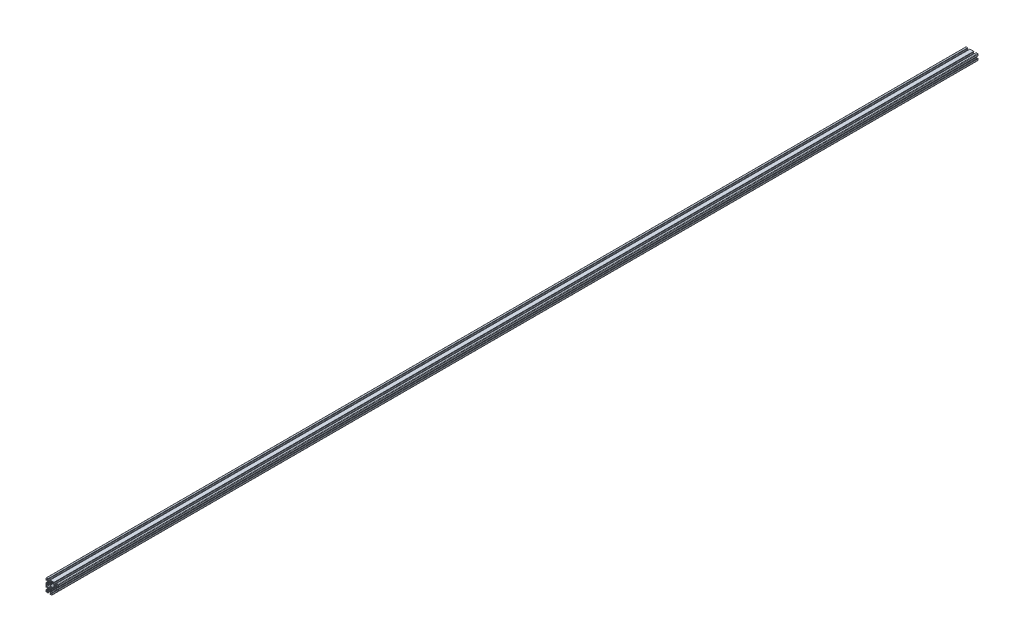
SolidWorks part; units mm, degrees
ref_plane "Front Plane" through (0, 0, 0) normal (0, 0, 1) x (1, 0, 0)
ref_plane "Top Plane" through (0, 0, 0) normal (0, 1, 0) x (1, 0, 0)
ref_plane "Right Plane" through (0, 0, 0) normal (1, 0, 0) x (0, 0, -1)
sketch "Sketch1" plane through (0, 0, 0) normal (0, 0, 1) x (1, 0, 0)
  line L0 (-3.2322, -4.5) -> (-0.9536, -4.5)
  line L1 (-0.8536, -4.4732) -> (-0.1, -4.0381)
  line L2 (0.1, -4.0381) -> (0.8536, -4.4732)
  line L3 (0.9536, -4.5) -> (3.2322, -4.5)
  line L4 (3.5858, -4.6464) -> (8.3536, -9.4142)
  line L5 (8.5, -12) -> (8.5, -9.7678)
  line L6 (-3.55, 9.7) -> (-3.55, 9.8)
  line L7 (-3.35, 9.5) -> (-3.2, 9.5)
  line L8 (-3, 9) -> (-3, 9.3)
  line L9 (-5.5, 8.5) -> (-3.5, 8.5)
  line L10 (-6, 7.2678) -> (-6, 8)
  line L12 (-3.2322, 4.5) -> (-0.9536, 4.5)
  line L13 (-0.8536, 4.4732) -> (-0.1, 4.0381)
  line L14 (0.1, 4.0381) -> (0.8536, 4.4732)
  line L15 (0.9536, 4.5) -> (3.2322, 4.5)
  line L16 (3.5858, 4.6464) -> (5.8536, 6.9142)
  line L17 (6, 7.2678) -> (6, 8)
  line L18 (5.5, 8.5) -> (3.5, 8.5)
  line L19 (3, 9) -> (3, 9.3)
  line L20 (3.2, 9.5) -> (3.3, 9.5)
  line L21 (3.5, 9.7) -> (3.5, 9.8)
  line L23 (3.7, 10) -> (16.2, 10)
  line L24 (16.4, 9.7) -> (16.4, 9.8)
  line L25 (16.6, 9.5) -> (16.8, 9.5)
  line L26 (17, 9) -> (17, 9.3)
  line L27 (14.5, 8.5) -> (16.5, 8.5)
  line L28 (14, 7.2678) -> (14, 8)
  line L29 (14.1464, 6.9142) -> (16.4142, 4.6464)
  line L30 (16.7678, 4.5) -> (19.0464, 4.5)
  line L31 (19.1464, 4.4732) -> (19.9, 4.0381)
  line L32 (20.1, 4.0381) -> (20.8536, 4.4732)
  line L33 (20.9536, 4.5) -> (23.2322, 4.5)
  line L34 (23.5858, 4.6464) -> (25.8536, 6.9142)
  line L35 (26, 7.2678) -> (26, 8)
  line L36 (25.5, 8.5) -> (23.5, 8.5)
  line L37 (23, 9) -> (23, 9.3)
  line L38 (23.2, 9.5) -> (23.3, 9.5)
  line L39 (23.5, 9.7) -> (23.5, 9.8)
  line L40 (23.7, 10) -> (28.5, 10)
  line L41 (30, 3.7) -> (30, 8.5)
  line L42 (29.7, 3.5) -> (29.8, 3.5)
  line L43 (29.5, 3.2) -> (29.5, 3.3)
  line L44 (29, 3) -> (29.3, 3)
  line L45 (28.5, 3.5) -> (28.5, 5.5)
  line L46 (27.2678, 6) -> (28, 6)
  line L47 (24.6464, 3.5858) -> (26.9142, 5.8536)
  line L48 (24.5, 0.9536) -> (24.5, 3.2322)
  line L49 (24.0381, 0.1) -> (24.4732, 0.8536)
  line L50 (24.0381, -0.1) -> (24.4732, -0.8536)
  line L51 (24.5, -3.2322) -> (24.5, -0.9536)
  line L52 (24.6464, -3.5858) -> (26.9142, -5.8536)
  line L53 (27.2678, -6) -> (28, -6)
  line L54 (28.5, -5.5) -> (28.5, -3.5)
  line L55 (29, -3) -> (29.3, -3)
  line L56 (29.5, -3.3) -> (29.5, -3.2)
  line L57 (29.7, -3.5) -> (29.8, -3.5)
  line L58 (30, -8.5) -> (30, -3.7)
  line L59 (23.7, -10) -> (28.5, -10)
  line L60 (23.5, -9.8) -> (23.5, -9.7)
  line L61 (23.2, -9.5) -> (23.3, -9.5)
  line L62 (23, -9.3) -> (23, -9)
  line L63 (23.5, -8.5) -> (25.5, -8.5)
  line L64 (26, -8) -> (26, -7.2678)
  line L65 (25.8536, -6.9142) -> (23.5858, -4.6464)
  line L66 (23.2322, -4.5) -> (20.9536, -4.5)
  line L67 (20.8536, -4.4732) -> (20.1, -4.0381)
  line L68 (19.1464, -4.4732) -> (19.9, -4.0381)
  line L69 (19.0464, -4.5) -> (16.7678, -4.5)
  line L70 (14.1464, -6.9142) -> (16.4142, -4.6464)
  line L71 (14, -8) -> (14, -7.2678)
  line L72 (14.5, -8.5) -> (16.5, -8.5)
  line L73 (17, -9.3) -> (17, -9)
  line L74 (16.65, -9.5) -> (16.8, -9.5)
  line L75 (16.45, -9.8) -> (16.45, -9.7)
  line L76 (11.5, -10) -> (16.25, -10)
  line L77 (10, -16.3) -> (10, -11.5)
  line L78 (9.8, -16.5) -> (9.7, -16.5)
  line L79 (9.5, -16.8) -> (9.5, -16.7)
  line L80 (9.3, -17) -> (9, -17)
  line L81 (8.5, -16.5) -> (8.5, -14.5)
  line L82 (7.2678, -14) -> (8, -14)
  line L83 (4.6464, -16.4142) -> (6.9142, -14.1464)
  line L84 (4.5, -19.0464) -> (4.5, -16.7678)
  line L85 (4.0381, -19.9) -> (4.4732, -19.1464)
  line L86 (4.0381, -20.1) -> (4.4732, -20.8536)
  line L87 (4.5, -23.2322) -> (4.5, -20.9536)
  line L88 (4.6464, -23.5858) -> (6.9142, -25.8536)
  line L89 (7.2678, -26) -> (8, -26)
  line L90 (8.5, -25.5) -> (8.5, -23.5)
  line L91 (9, -23) -> (9.3, -23)
  line L92 (9.5, -23.3) -> (9.5, -23.2)
  line L93 (9.7, -23.5) -> (9.8, -23.5)
  line L94 (10, -28.5) -> (10, -23.7)
  line L95 (8.5, -30) -> (3.7, -30)
  line L96 (3.5, -29.8) -> (3.5, -29.7)
  line L97 (3.3, -29.5) -> (3.2, -29.5)
  line L98 (3, -29.3) -> (3, -29)
  line L99 (3.5, -28.5) -> (5.5, -28.5)
  line L100 (6, -28) -> (6, -27.2678)
  line L101 (5.8536, -26.9142) -> (3.5858, -24.6464)
  line L102 (3.2322, -24.5) -> (0.9536, -24.5)
  line L103 (0.8536, -24.4732) -> (0.1, -24.0381)
  line L104 (-0.8536, -24.4732) -> (-0.1, -24.0381)
  line L105 (-0.9536, -24.5) -> (-3.2322, -24.5)
  line L106 (-5.8536, -26.9142) -> (-3.5858, -24.6464)
  line L107 (-6, -28) -> (-6, -27.2678)
  line L108 (-5.5, -28.5) -> (-3.5, -28.5)
  line L109 (-3, -29.3) -> (-3, -29)
  line L110 (-3.2, -29.5) -> (-3.3, -29.5)
  line L111 (-3.5, -29.8) -> (-3.5, -29.7)
  line L112 (-3.7, -30) -> (-8.5, -30)
  line L113 (-10, -28.5) -> (-10, -23.75)
  line L114 (-9.8, -23.55) -> (-9.7, -23.55)
  line L115 (-9.5, -23.35) -> (-9.5, -23.2)
  line L116 (-9.3, -23) -> (-9, -23)
  line L117 (-8.5, -23.5) -> (-8.5, -25.5)
  line L118 (-8, -26) -> (-7.2678, -26)
  line L119 (-6.9142, -25.8536) -> (-4.6464, -23.5858)
  line L120 (-4.5, -23.2322) -> (-4.5, -20.9536)
  line L121 (-4.4732, -20.8536) -> (-4.0381, -20.1)
  line L122 (-4.0381, -19.9) -> (-4.4732, -19.1464)
  line L123 (-4.5, -19.0464) -> (-4.5, -16.7678)
  line L124 (-4.6464, -16.4142) -> (-6.9142, -14.1464)
  line L125 (-7.2678, -14) -> (-8, -14)
  line L126 (-8.5, -16.5) -> (-8.5, -14.5)
  line L127 (-9, -17) -> (-9.3, -17)
  line L128 (-9.5, -16.8) -> (-9.5, -16.65)
  line L129 (-9.7, -16.45) -> (-9.8, -16.45)
  line L131 (2.5259, 1.3623) -> (2.8916, 1.8006)
  line L132 (1.3623, 2.5259) -> (1.8006, 2.8916)
  line L133 (-1.3623, 2.5259) -> (-1.8006, 2.8916)
  line L134 (-2.8912, 1.8002) -> (-2.5243, 1.3629)
  line L135 (-2.8912, -1.8002) -> (-2.5243, -1.3629)
  line L136 (-1.7927, -2.8965) -> (-1.3554, -2.5296)
  line L137 (1.3623, -2.5259) -> (1.8006, -2.8916)
  line L138 (2.8916, -1.8006) -> (2.5259, -1.3623)
  line L139 (3.2322, -15.5) -> (0.9536, -15.5)
  line L140 (-1.3623, -17.4741) -> (-1.8006, -17.1084)
  line L141 (-2.8916, -18.1994) -> (-2.5259, -18.6377)
  line L142 (-2.8916, -21.8006) -> (-2.5259, -21.3623)
  line L143 (-1.8006, -22.8916) -> (-1.3623, -22.5259)
  line L144 (1.3623, -22.5259) -> (1.8006, -22.8916)
  line L145 (2.8916, -21.8006) -> (2.5259, -21.3623)
  line L146 (2.5259, -18.6377) -> (2.8916, -18.1994)
  line L147 (1.3623, -17.4741) -> (1.8006, -17.1084)
  line L148 (-8.5, -12) -> (-8.5, -8)
  line L149 (-7.2678, -12.5) -> (-8, -12.5)
  line L150 (-0.9536, -15.5) -> (-3.2322, -15.5)
  line L151 (-3.5858, -15.3536) -> (-5.8536, -13.0858)
  line L152 (0.8536, -15.5268) -> (0.1, -15.9619)
  line L153 (-0.1, -15.9619) -> (-0.8536, -15.5268)
  line L154 (-9.8, 3.55) -> (-9.7, 3.55)
  line L155 (-9.5, 3.2) -> (-9.5, 3.35)
  line L156 (-9.3, 3) -> (-9, 3)
  line L157 (-8.5, 3.5) -> (-8.5, 5.5)
  line L158 (-8, 6) -> (-7.2678, 6)
  line L159 (-6.9142, 5.8536) -> (-4.6464, 3.5858)
  line L160 (-4.5, 0.9536) -> (-4.5, 3.2322)
  line L161 (-4.4732, 0.8536) -> (-4.0381, 0.1)
  line L162 (-4.4732, -0.8536) -> (-4.0381, -0.1)
  line L163 (-4.5, -3.2322) -> (-4.5, -0.9536)
  line L164 (-6.9142, -5.8536) -> (-4.6464, -3.5858)
  line L165 (-7.2678, -6) -> (-8, -6)
  line L166 (-8.5, -5.5) -> (-8.5, -3.5)
  line L167 (-9, -3) -> (-9.3, -3)
  line L168 (-9.5, -3.35) -> (-9.5, -3.2)
  line L169 (-9.7, -3.55) -> (-9.8, -3.55)
  line L170 (-10, 3.75) -> (-10, 8.5)
  line L171 (-8.5, 10) -> (-3.75, 10)
  line L172 (-10, -16.25) -> (-10, -3.75)
  line L173 (-7.2678, -7.5) -> (-8, -7.5)
  line L174 (-3.5858, -4.6464) -> (-5.8536, -6.9142)
  line L175 (-3.5858, 4.6464) -> (-5.8536, 6.9142)
  line L176 (5.8536, -13.0858) -> (3.5858, -15.3536)
  line L177 (7.2678, -12.5) -> (8, -12.5)
  line L178 (17.4688, 1.3572) -> (17.1088, 1.8002)
  line L179 (18.1998, 2.8912) -> (18.6428, 2.5312)
  line L180 (21.3554, 2.5296) -> (21.7983, 2.8897)
  line L181 (22.5296, 1.3554) -> (22.8897, 1.7983)
  line L182 (22.5296, -1.3554) -> (22.8897, -1.7983)
  line L183 (21.7983, -2.8897) -> (21.3554, -2.5296)
  line L184 (18.1998, -2.8912) -> (18.6428, -2.5312)
  line L185 (17.1088, -1.8002) -> (17.4688, -1.3572)
  line L186 (12, -8.5) -> (9.7678, -8.5)
  line L187 (12, 8.5) -> (8, 8.5)
  line L188 (4.0381, 0.1) -> (4.4732, 0.8536)
  line L189 (9.4142, -8.3536) -> (4.6464, -3.5858)
  line L190 (4.5, -3.2322) -> (4.5, -0.9536)
  line L191 (4.4732, -0.8536) -> (4.0381, -0.1)
  line L192 (4.6464, 3.5858) -> (6.9142, 5.8536)
  line L193 (4.5, 0.9536) -> (4.5, 3.2322)
  line L194 (7.5, 7.2678) -> (7.5, 8)
  line L195 (15.9619, 0.1) -> (15.5268, 0.8536)
  line L196 (15.5268, -0.8536) -> (15.9619, -0.1)
  line L197 (13.0858, -5.8536) -> (15.3536, -3.5858)
  line L198 (12.5, -7.2678) -> (12.5, -8)
  line L199 (15.5, -3.2322) -> (15.5, -0.9536)
  line L200 (15.3536, 3.5858) -> (13.0858, 5.8536)
  line L201 (15.5, 0.9536) -> (15.5, 3.2322)
  line L202 (12.5, 7.2678) -> (12.5, 8)
  line L203 (0, 11.9931) -> (0, -30.4658) construction
  line L204 (-13.2913, 0) -> (29.7, 0) construction
  line L205 (20, 11.9931) -> (20, -22.0156) construction
  line L206 (-15.5823, -20) -> (12, -20) construction
  line L207 (10, 11.9931) -> (10, -32.444) construction
  line L208 (-14.6648, -10) -> (36.8031, -10) construction
  arc A0 (-0.9536, -4.5) -> (-0.8536, -4.4732) centre (-0.9536, -4.3) ccw
  arc A1 (0.1, -4.0381) -> (-0.1, -4.0381) centre (0, -4.2113) ccw
  arc A2 (0.8536, -4.4732) -> (0.9536, -4.5) centre (0.9536, -4.3) ccw
  arc A3 (3.5858, -4.6464) -> (3.2322, -4.5) centre (3.2322, -5) ccw
  arc A4 (8.5, -9.7678) -> (8.3536, -9.4142) centre (8, -9.7678) ccw
  arc A5 (-3.55, 9.8) -> (-3.75, 10) centre (-3.75, 9.8) ccw
  arc A6 (-3.55, 9.7) -> (-3.35, 9.5) centre (-3.35, 9.7) ccw
  arc A7 (-3, 9.3) -> (-3.2, 9.5) centre (-3.2, 9.3) ccw
  arc A8 (-3.5, 8.5) -> (-3, 9) centre (-3.5, 9) ccw
  arc A9 (-5.5, 8.5) -> (-6, 8) centre (-5.5, 8) ccw
  arc A10 (-6, 7.2678) -> (-5.8536, 6.9142) centre (-5.5, 7.2678) ccw
  arc A11 (-3.5858, 4.6464) -> (-3.2322, 4.5) centre (-3.2322, 5) ccw
  arc A12 (-0.8536, 4.4732) -> (-0.9536, 4.5) centre (-0.9536, 4.3) ccw
  arc A13 (-0.1, 4.0381) -> (0.1, 4.0381) centre (0, 4.2113) ccw
  arc A14 (0.9536, 4.5) -> (0.8536, 4.4732) centre (0.9536, 4.3) ccw
  arc A15 (3.2322, 4.5) -> (3.5858, 4.6464) centre (3.2322, 5) ccw
  arc A16 (5.8536, 6.9142) -> (6, 7.2678) centre (5.5, 7.2678) ccw
  arc A17 (6, 8) -> (5.5, 8.5) centre (5.5, 8) ccw
  arc A18 (3, 9) -> (3.5, 8.5) centre (3.5, 9) ccw
  arc A19 (3.2, 9.5) -> (3, 9.3) centre (3.2, 9.3) ccw
  arc A20 (3.3, 9.5) -> (3.5, 9.7) centre (3.3, 9.7) ccw
  arc A21 (3.7, 10) -> (3.5, 9.8) centre (3.7, 9.8) ccw
  arc A22 (16.4, 9.8) -> (16.2, 10) centre (16.2, 9.8) ccw
  arc A23 (16.4, 9.7) -> (16.6, 9.5) centre (16.6, 9.7) ccw
  arc A24 (17, 9.3) -> (16.8, 9.5) centre (16.8, 9.3) ccw
  arc A25 (16.5, 8.5) -> (17, 9) centre (16.5, 9) ccw
  arc A26 (14.5, 8.5) -> (14, 8) centre (14.5, 8) ccw
  arc A27 (14, 7.2678) -> (14.1464, 6.9142) centre (14.5, 7.2678) ccw
  arc A28 (16.4142, 4.6464) -> (16.7678, 4.5) centre (16.7678, 5) ccw
  arc A29 (19.1464, 4.4732) -> (19.0464, 4.5) centre (19.0464, 4.3) ccw
  arc A30 (19.9, 4.0381) -> (20.1, 4.0381) centre (20, 4.2113) ccw
  arc A31 (20.9536, 4.5) -> (20.8536, 4.4732) centre (20.9536, 4.3) ccw
  arc A32 (23.2322, 4.5) -> (23.5858, 4.6464) centre (23.2322, 5) ccw
  arc A33 (25.8536, 6.9142) -> (26, 7.2678) centre (25.5, 7.2678) ccw
  arc A34 (26, 8) -> (25.5, 8.5) centre (25.5, 8) ccw
  arc A35 (23, 9) -> (23.5, 8.5) centre (23.5, 9) ccw
  arc A36 (23.2, 9.5) -> (23, 9.3) centre (23.2, 9.3) ccw
  arc A37 (23.3, 9.5) -> (23.5, 9.7) centre (23.3, 9.7) ccw
  arc A38 (23.7, 10) -> (23.5, 9.8) centre (23.7, 9.8) ccw
  arc A39 (30, 8.5) -> (28.5, 10) centre (28.5, 8.5) ccw
  arc A40 (29.8, 3.5) -> (30, 3.7) centre (29.8, 3.7) ccw
  arc A41 (29.7, 3.5) -> (29.5, 3.3) centre (29.7, 3.3) ccw
  arc A42 (29.3, 3) -> (29.5, 3.2) centre (29.3, 3.2) ccw
  arc A43 (28.5, 3.5) -> (29, 3) centre (29, 3.5) ccw
  arc A44 (28.5, 5.5) -> (28, 6) centre (28, 5.5) ccw
  arc A45 (27.2678, 6) -> (26.9142, 5.8536) centre (27.2678, 5.5) ccw
  arc A46 (24.6464, 3.5858) -> (24.5, 3.2322) centre (25, 3.2322) ccw
  arc A47 (24.4732, 0.8536) -> (24.5, 0.9536) centre (24.3, 0.9536) ccw
  arc A48 (24.0381, 0.1) -> (24.0381, -0.1) centre (24.2113, 0) ccw
  arc A49 (24.5, -0.9536) -> (24.4732, -0.8536) centre (24.3, -0.9536) ccw
  arc A50 (24.5, -3.2322) -> (24.6464, -3.5858) centre (25, -3.2322) ccw
  arc A51 (26.9142, -5.8536) -> (27.2678, -6) centre (27.2678, -5.5) ccw
  arc A52 (28, -6) -> (28.5, -5.5) centre (28, -5.5) ccw
  arc A53 (29, -3) -> (28.5, -3.5) centre (29, -3.5) ccw
  arc A54 (29.5, -3.2) -> (29.3, -3) centre (29.3, -3.2) ccw
  arc A55 (29.5, -3.3) -> (29.7, -3.5) centre (29.7, -3.3) ccw
  arc A56 (30, -3.7) -> (29.8, -3.5) centre (29.8, -3.7) ccw
  arc A57 (28.5, -10) -> (30, -8.5) centre (28.5, -8.5) ccw
  arc A58 (23.5, -9.8) -> (23.7, -10) centre (23.7, -9.8) ccw
  arc A59 (23.5, -9.7) -> (23.3, -9.5) centre (23.3, -9.7) ccw
  arc A60 (23, -9.3) -> (23.2, -9.5) centre (23.2, -9.3) ccw
  arc A61 (23.5, -8.5) -> (23, -9) centre (23.5, -9) ccw
  arc A62 (25.5, -8.5) -> (26, -8) centre (25.5, -8) ccw
  arc A63 (26, -7.2678) -> (25.8536, -6.9142) centre (25.5, -7.2678) ccw
  arc A64 (23.5858, -4.6464) -> (23.2322, -4.5) centre (23.2322, -5) ccw
  arc A65 (20.8536, -4.4732) -> (20.9536, -4.5) centre (20.9536, -4.3) ccw
  arc A66 (20.1, -4.0381) -> (19.9, -4.0381) centre (20, -4.2113) ccw
  arc A67 (19.0464, -4.5) -> (19.1464, -4.4732) centre (19.0464, -4.3) ccw
  arc A68 (16.7678, -4.5) -> (16.4142, -4.6464) centre (16.7678, -5) ccw
  arc A69 (14.1464, -6.9142) -> (14, -7.2678) centre (14.5, -7.2678) ccw
  arc A70 (14, -8) -> (14.5, -8.5) centre (14.5, -8) ccw
  arc A71 (17, -9) -> (16.5, -8.5) centre (16.5, -9) ccw
  arc A72 (16.8, -9.5) -> (17, -9.3) centre (16.8, -9.3) ccw
  arc A73 (16.65, -9.5) -> (16.45, -9.7) centre (16.65, -9.7) ccw
  arc A74 (16.25, -10) -> (16.45, -9.8) centre (16.25, -9.8) ccw
  arc A75 (11.5, -10) -> (10, -11.5) centre (11.5, -11.5) ccw
  arc A76 (9.8, -16.5) -> (10, -16.3) centre (9.8, -16.3) ccw
  arc A77 (9.7, -16.5) -> (9.5, -16.7) centre (9.7, -16.7) ccw
  arc A78 (9.3, -17) -> (9.5, -16.8) centre (9.3, -16.8) ccw
  arc A79 (8.5, -16.5) -> (9, -17) centre (9, -16.5) ccw
  arc A80 (8.5, -14.5) -> (8, -14) centre (8, -14.5) ccw
  arc A81 (7.2678, -14) -> (6.9142, -14.1464) centre (7.2678, -14.5) ccw
  arc A82 (4.6464, -16.4142) -> (4.5, -16.7678) centre (5, -16.7678) ccw
  arc A83 (4.4732, -19.1464) -> (4.5, -19.0464) centre (4.3, -19.0464) ccw
  arc A84 (4.0381, -19.9) -> (4.0381, -20.1) centre (4.2113, -20) ccw
  arc A85 (4.5, -20.9536) -> (4.4732, -20.8536) centre (4.3, -20.9536) ccw
  arc A86 (4.5, -23.2322) -> (4.6464, -23.5858) centre (5, -23.2322) ccw
  arc A87 (6.9142, -25.8536) -> (7.2678, -26) centre (7.2678, -25.5) ccw
  arc A88 (8, -26) -> (8.5, -25.5) centre (8, -25.5) ccw
  arc A89 (9, -23) -> (8.5, -23.5) centre (9, -23.5) ccw
  arc A90 (9.5, -23.2) -> (9.3, -23) centre (9.3, -23.2) ccw
  arc A91 (9.5, -23.3) -> (9.7, -23.5) centre (9.7, -23.3) ccw
  arc A92 (10, -23.7) -> (9.8, -23.5) centre (9.8, -23.7) ccw
  arc A93 (8.5, -30) -> (10, -28.5) centre (8.5, -28.5) ccw
  arc A94 (3.5, -29.8) -> (3.7, -30) centre (3.7, -29.8) ccw
  arc A95 (3.5, -29.7) -> (3.3, -29.5) centre (3.3, -29.7) ccw
  arc A96 (3, -29.3) -> (3.2, -29.5) centre (3.2, -29.3) ccw
  arc A97 (3.5, -28.5) -> (3, -29) centre (3.5, -29) ccw
  arc A98 (5.5, -28.5) -> (6, -28) centre (5.5, -28) ccw
  arc A99 (6, -27.2678) -> (5.8536, -26.9142) centre (5.5, -27.2678) ccw
  arc A100 (3.5858, -24.6464) -> (3.2322, -24.5) centre (3.2322, -25) ccw
  arc A101 (0.8536, -24.4732) -> (0.9536, -24.5) centre (0.9536, -24.3) ccw
  arc A102 (0.1, -24.0381) -> (-0.1, -24.0381) centre (0, -24.2113) ccw
  arc A103 (-0.9536, -24.5) -> (-0.8536, -24.4732) centre (-0.9536, -24.3) ccw
  arc A104 (-3.2322, -24.5) -> (-3.5858, -24.6464) centre (-3.2322, -25) ccw
  arc A105 (-5.8536, -26.9142) -> (-6, -27.2678) centre (-5.5, -27.2678) ccw
  arc A106 (-6, -28) -> (-5.5, -28.5) centre (-5.5, -28) ccw
  arc A107 (-3, -29) -> (-3.5, -28.5) centre (-3.5, -29) ccw
  arc A108 (-3.2, -29.5) -> (-3, -29.3) centre (-3.2, -29.3) ccw
  arc A109 (-3.3, -29.5) -> (-3.5, -29.7) centre (-3.3, -29.7) ccw
  arc A110 (-3.7, -30) -> (-3.5, -29.8) centre (-3.7, -29.8) ccw
  arc A111 (-10, -28.5) -> (-8.5, -30) centre (-8.5, -28.5) ccw
  arc A112 (-9.8, -23.55) -> (-10, -23.75) centre (-9.8, -23.75) ccw
  arc A113 (-9.7, -23.55) -> (-9.5, -23.35) centre (-9.7, -23.35) ccw
  arc A114 (-9.3, -23) -> (-9.5, -23.2) centre (-9.3, -23.2) ccw
  arc A115 (-8.5, -23.5) -> (-9, -23) centre (-9, -23.5) ccw
  arc A116 (-8.5, -25.5) -> (-8, -26) centre (-8, -25.5) ccw
  arc A117 (-7.2678, -26) -> (-6.9142, -25.8536) centre (-7.2678, -25.5) ccw
  arc A118 (-4.6464, -23.5858) -> (-4.5, -23.2322) centre (-5, -23.2322) ccw
  arc A119 (-4.4732, -20.8536) -> (-4.5, -20.9536) centre (-4.3, -20.9536) ccw
  arc A120 (-4.0381, -20.1) -> (-4.0381, -19.9) centre (-4.2113, -20) ccw
  arc A121 (-4.5, -19.0464) -> (-4.4732, -19.1464) centre (-4.3, -19.0464) ccw
  arc A122 (-4.5, -16.7678) -> (-4.6464, -16.4142) centre (-5, -16.7678) ccw
  arc A123 (-6.9142, -14.1464) -> (-7.2678, -14) centre (-7.2678, -14.5) ccw
  arc A124 (-8, -14) -> (-8.5, -14.5) centre (-8, -14.5) ccw
  arc A125 (-9, -17) -> (-8.5, -16.5) centre (-9, -16.5) ccw
  arc A126 (-9.5, -16.8) -> (-9.3, -17) centre (-9.3, -16.8) ccw
  arc A127 (-9.5, -16.65) -> (-9.7, -16.45) centre (-9.7, -16.65) ccw
  arc A128 (-10, -16.25) -> (-9.8, -16.45) centre (-9.8, -16.25) ccw
  arc A129 (2.75, 0) -> (2.4978, 1.1505) centre (0, 0) ccw
  arc A130 (2.5259, 1.3623) -> (2.4978, 1.1505) centre (2.6794, 1.2342) ccw
  arc A131 (2.8916, 1.8006) -> (2.9015, 2.0439) centre (2.738, 1.9287) ccw
  arc A132 (2.9015, 2.0439) -> (2.0439, 2.9015) centre (0, 0) ccw
  arc A133 (2.0439, 2.9015) -> (1.8006, 2.8916) centre (1.9287, 2.738) ccw
  arc A134 (1.1505, 2.4978) -> (1.3623, 2.5259) centre (1.2342, 2.6794) ccw
  arc A135 (1.1505, 2.4978) -> (-1.1505, 2.4978) centre (0, 0) ccw
  arc A136 (-1.3623, 2.5259) -> (-1.1505, 2.4978) centre (-1.2342, 2.6794) ccw
  arc A137 (-1.8006, 2.8916) -> (-2.0439, 2.9015) centre (-1.9287, 2.738) ccw
  arc A138 (-2.0439, 2.9015) -> (-2.9015, 2.0439) centre (0, 0) ccw
  arc A139 (-2.9015, 2.0439) -> (-2.8912, 1.8002) centre (-2.738, 1.9287) ccw
  arc A140 (-2.4869, 1.1738) -> (-2.5243, 1.3629) centre (-2.6775, 1.2343) ccw
  arc A141 (-2.4869, 1.1738) -> (-2.4971, -1.152) centre (0, 0) ccw
  arc A142 (-2.5243, -1.3629) -> (-2.4971, -1.152) centre (-2.6787, -1.2357) ccw
  arc A143 (-2.8912, -1.8002) -> (-2.9015, -2.0439) centre (-2.738, -1.9287) ccw
  arc A144 (-2.9015, -2.0439) -> (-2.0359, -2.9071) centre (0, 0) ccw
  arc A145 (-2.0359, -2.9071) -> (-1.7927, -2.8965) centre (-1.9212, -2.7433) ccw
  arc A146 (-1.1436, -2.5009) -> (-1.3554, -2.5296) centre (-1.2268, -2.6828) ccw
  arc A147 (-1.1436, -2.5009) -> (1.1505, -2.4978) centre (0, 0) ccw
  arc A148 (1.3623, -2.5259) -> (1.1505, -2.4978) centre (1.2342, -2.6794) ccw
  arc A149 (1.8006, -2.8916) -> (2.0439, -2.9015) centre (1.9287, -2.738) ccw
  arc A150 (2.0439, -2.9015) -> (2.9015, -2.0439) centre (0, 0) ccw
  arc A151 (2.9015, -2.0439) -> (2.8916, -1.8006) centre (2.738, -1.9287) ccw
  arc A152 (2.4978, -1.1505) -> (2.5259, -1.3623) centre (2.6794, -1.2342) ccw
  arc A153 (2.4978, -1.1505) -> (2.75, 0) centre (0, 0) ccw
  arc A154 (0, -17.25) -> (-1.1505, -17.5022) centre (0, -20) ccw
  arc A155 (-1.3623, -17.4741) -> (-1.1505, -17.5022) centre (-1.2342, -17.3206) ccw
  arc A156 (-1.8006, -17.1084) -> (-2.0439, -17.0985) centre (-1.9287, -17.262) ccw
  arc A157 (-2.0439, -17.0985) -> (-2.9015, -17.9561) centre (0, -20) ccw
  arc A158 (-2.9015, -17.9561) -> (-2.8916, -18.1994) centre (-2.738, -18.0713) ccw
  arc A159 (-2.4978, -18.8495) -> (-2.5259, -18.6377) centre (-2.6794, -18.7658) ccw
  arc A160 (-2.4978, -18.8495) -> (-2.4978, -21.1505) centre (0, -20) ccw
  arc A161 (-2.5259, -21.3623) -> (-2.4978, -21.1505) centre (-2.6794, -21.2342) ccw
  arc A162 (-2.8916, -21.8006) -> (-2.9015, -22.0439) centre (-2.738, -21.9287) ccw
  arc A163 (-2.9015, -22.0439) -> (-2.0439, -22.9015) centre (0, -20) ccw
  arc A164 (-2.0439, -22.9015) -> (-1.8006, -22.8916) centre (-1.9287, -22.738) ccw
  arc A165 (-1.1505, -22.4978) -> (-1.3623, -22.5259) centre (-1.2342, -22.6794) ccw
  arc A166 (-1.1505, -22.4978) -> (1.1505, -22.4978) centre (0, -20) ccw
  arc A167 (1.3623, -22.5259) -> (1.1505, -22.4978) centre (1.2342, -22.6794) ccw
  arc A168 (1.8006, -22.8916) -> (2.0439, -22.9015) centre (1.9287, -22.738) ccw
  arc A169 (2.0439, -22.9015) -> (2.9015, -22.0439) centre (0, -20) ccw
  arc A170 (2.9015, -22.0439) -> (2.8916, -21.8006) centre (2.738, -21.9287) ccw
  arc A171 (2.4978, -21.1505) -> (2.5259, -21.3623) centre (2.6794, -21.2342) ccw
  arc A172 (2.4978, -21.1505) -> (2.4978, -18.8495) centre (0, -20) ccw
  arc A173 (2.5259, -18.6377) -> (2.4978, -18.8495) centre (2.6794, -18.7658) ccw
  arc A174 (2.8916, -18.1994) -> (2.9015, -17.9561) centre (2.738, -18.0713) ccw
  arc A175 (2.9015, -17.9561) -> (2.0439, -17.0985) centre (0, -20) ccw
  arc A176 (2.0439, -17.0985) -> (1.8006, -17.1084) centre (1.9287, -17.262) ccw
  arc A177 (1.1505, -17.5022) -> (1.3623, -17.4741) centre (1.2342, -17.3206) ccw
  arc A178 (1.1505, -17.5022) -> (0, -17.25) centre (0, -20) ccw
  arc A179 (-5.8536, -13.0858) -> (-7.2678, -12.5) centre (-7.2678, -14.5) ccw
  arc A180 (-8.5, -12) -> (-8, -12.5) centre (-8, -12) ccw
  arc A181 (-3.5858, -15.3536) -> (-3.2322, -15.5) centre (-3.2322, -15) ccw
  arc A182 (-0.8536, -15.5268) -> (-0.9536, -15.5) centre (-0.9536, -15.7) ccw
  arc A183 (-0.1, -15.9619) -> (0.1, -15.9619) centre (0, -15.7887) ccw
  arc A184 (0.9536, -15.5) -> (0.8536, -15.5268) centre (0.9536, -15.7) ccw
  arc A185 (-10, 3.75) -> (-9.8, 3.55) centre (-9.8, 3.75) ccw
  arc A186 (-9.5, 3.35) -> (-9.7, 3.55) centre (-9.7, 3.35) ccw
  arc A187 (-9.5, 3.2) -> (-9.3, 3) centre (-9.3, 3.2) ccw
  arc A188 (-9, 3) -> (-8.5, 3.5) centre (-9, 3.5) ccw
  arc A189 (-8, 6) -> (-8.5, 5.5) centre (-8, 5.5) ccw
  arc A190 (-6.9142, 5.8536) -> (-7.2678, 6) centre (-7.2678, 5.5) ccw
  arc A191 (-4.5, 3.2322) -> (-4.6464, 3.5858) centre (-5, 3.2322) ccw
  arc A192 (-4.5, 0.9536) -> (-4.4732, 0.8536) centre (-4.3, 0.9536) ccw
  arc A193 (-4.0381, -0.1) -> (-4.0381, 0.1) centre (-4.2113, 0) ccw
  arc A194 (-4.4732, -0.8536) -> (-4.5, -0.9536) centre (-4.3, -0.9536) ccw
  arc A195 (-4.6464, -3.5858) -> (-4.5, -3.2322) centre (-5, -3.2322) ccw
  arc A196 (-7.2678, -6) -> (-6.9142, -5.8536) centre (-7.2678, -5.5) ccw
  arc A197 (-8.5, -5.5) -> (-8, -6) centre (-8, -5.5) ccw
  arc A198 (-8.5, -3.5) -> (-9, -3) centre (-9, -3.5) ccw
  arc A199 (-9.3, -3) -> (-9.5, -3.2) centre (-9.3, -3.2) ccw
  arc A200 (-9.7, -3.55) -> (-9.5, -3.35) centre (-9.7, -3.35) ccw
  arc A201 (-9.8, -3.55) -> (-10, -3.75) centre (-9.8, -3.75) ccw
  arc A202 (-8.5, 10) -> (-10, 8.5) centre (-8.5, 8.5) ccw
  arc A203 (-7.2678, -7.5) -> (-5.8536, -6.9142) centre (-7.2678, -5.5) ccw
  arc A204 (-8, -7.5) -> (-8.5, -8) centre (-8, -8) ccw
  arc A205 (-3.2322, -4.5) -> (-3.5858, -4.6464) centre (-3.2322, -5) ccw
  arc A206 (7.2678, -12.5) -> (5.8536, -13.0858) centre (7.2678, -14.5) ccw
  arc A207 (3.2322, -15.5) -> (3.5858, -15.3536) centre (3.2322, -15) ccw
  arc A208 (8, -12.5) -> (8.5, -12) centre (8, -12) ccw
  arc A209 (17.4991, 1.1436) -> (17.25, 0) centre (20, 0) ccw
  arc A210 (17.4991, 1.1436) -> (17.4688, 1.3572) centre (17.3172, 1.2268) ccw
  arc A211 (17.0985, 2.0439) -> (17.1088, 1.8002) centre (17.262, 1.9287) ccw
  arc A212 (17.9561, 2.9015) -> (17.0985, 2.0439) centre (20, 0) ccw
  arc A213 (18.1998, 2.8912) -> (17.9561, 2.9015) centre (18.0713, 2.738) ccw
  arc A214 (18.6428, 2.5312) -> (18.8564, 2.5009) centre (18.7732, 2.6828) ccw
  arc A215 (20, 2.75) -> (18.8564, 2.5009) centre (20, 0) ccw
  arc A216 (21.1436, 2.5009) -> (20, 2.75) centre (20, 0) ccw
  arc A217 (21.1436, 2.5009) -> (21.3554, 2.5296) centre (21.2268, 2.6828) ccw
  arc A218 (22.0439, 2.9015) -> (21.7983, 2.8897) centre (21.9287, 2.738) ccw
  arc A219 (22.9015, 2.0439) -> (22.0439, 2.9015) centre (20, 0) ccw
  arc A220 (22.8897, 1.7983) -> (22.9015, 2.0439) centre (22.738, 1.9287) ccw
  arc A221 (22.5296, 1.3554) -> (22.5009, 1.1436) centre (22.6828, 1.2268) ccw
  arc A222 (22.75, 0) -> (22.5009, 1.1436) centre (20, 0) ccw
  arc A223 (22.5009, -1.1436) -> (22.75, 0) centre (20, 0) ccw
  arc A224 (22.5009, -1.1436) -> (22.5296, -1.3554) centre (22.6828, -1.2268) ccw
  arc A225 (22.9015, -2.0439) -> (22.8897, -1.7983) centre (22.738, -1.9287) ccw
  arc A226 (22.0439, -2.9015) -> (22.9015, -2.0439) centre (20, 0) ccw
  arc A227 (21.7983, -2.8897) -> (22.0439, -2.9015) centre (21.9287, -2.738) ccw
  arc A228 (21.3554, -2.5296) -> (21.1436, -2.5009) centre (21.2268, -2.6828) ccw
  arc A229 (20, -2.75) -> (21.1436, -2.5009) centre (20, 0) ccw
  arc A230 (18.8564, -2.5009) -> (20, -2.75) centre (20, 0) ccw
  arc A231 (18.8564, -2.5009) -> (18.6428, -2.5312) centre (18.7732, -2.6828) ccw
  arc A232 (17.9561, -2.9015) -> (18.1998, -2.8912) centre (18.0713, -2.738) ccw
  arc A233 (17.0985, -2.0439) -> (17.9561, -2.9015) centre (20, 0) ccw
  arc A234 (17.1088, -1.8002) -> (17.0985, -2.0439) centre (17.262, -1.9287) ccw
  arc A235 (17.4688, -1.3572) -> (17.4991, -1.1436) centre (17.3172, -1.2268) ccw
  arc A236 (17.25, 0) -> (17.4991, -1.1436) centre (20, 0) ccw
  arc A237 (4.0381, 0.1) -> (4.0381, -0.1) centre (4.2113, 0) ccw
  arc A238 (4.5, -3.2322) -> (4.6464, -3.5858) centre (5, -3.2322) ccw
  arc A239 (4.5, -0.9536) -> (4.4732, -0.8536) centre (4.3, -0.9536) ccw
  arc A240 (9.4142, -8.3536) -> (9.7678, -8.5) centre (9.7678, -8) ccw
  arc A241 (6.9142, 5.8536) -> (7.5, 7.2678) centre (5.5, 7.2678) ccw
  arc A242 (4.6464, 3.5858) -> (4.5, 3.2322) centre (5, 3.2322) ccw
  arc A243 (3.0003, 4.5) -> (3, 4.5) centre (3, 3) ccw
  arc A244 (4.4732, 0.8536) -> (4.5, 0.9536) centre (4.3, 0.9536) ccw
  arc A245 (8, 8.5) -> (7.5, 8) centre (8, 8) ccw
  arc A246 (12, -8.5) -> (12.5, -8) centre (12, -8) ccw
  arc A247 (13.0858, -5.8536) -> (12.5, -7.2678) centre (14.5, -7.2678) ccw
  arc A248 (15.3536, -3.5858) -> (15.5, -3.2322) centre (15, -3.2322) ccw
  arc A249 (15.5268, -0.8536) -> (15.5, -0.9536) centre (15.7, -0.9536) ccw
  arc A250 (15.9619, -0.1) -> (15.9619, 0.1) centre (15.7887, 0) ccw
  arc A251 (12.5, 7.2678) -> (13.0858, 5.8536) centre (14.5, 7.2678) ccw
  arc A252 (15.5, 0.9536) -> (15.5268, 0.8536) centre (15.7, 0.9536) ccw
  arc A253 (15.5, 3.2322) -> (15.3536, 3.5858) centre (15, 3.2322) ccw
  arc A254 (12.5, 8) -> (12, 8.5) centre (12, 8) ccw
  dimension "D5" = 5.5
  dimension "D1" = 20
  dimension "D2" = 20
  dimension "D3" = 10
  dimension "D4" = 10
  dimension "D6" = 6
  dimension "D7" = 20
  dimension "D8" = 40
  dimension "D9" = 20
  dimension "D10" = 40
  dimension "D11" = 6
  dimension "D12" = 6
  dimension "D13" = 6
extrude "Extrude1" add sketch "Sketch1" along normal blind 3000 contours L171 A202 L170 A185 L154 A186 L155 A187 L156 A188 L157 A189 L158 A190 L159 A191 L160 A192 L161 A193 L162 A194 L163 A195 L164 A196 L165 A197 L166 A198 L167 A199 L168 A200 L169 A201 L172 A128 L129 A127 L128 A126 L127 A125 L126 A124 L125 A123 L124 A122 L123
